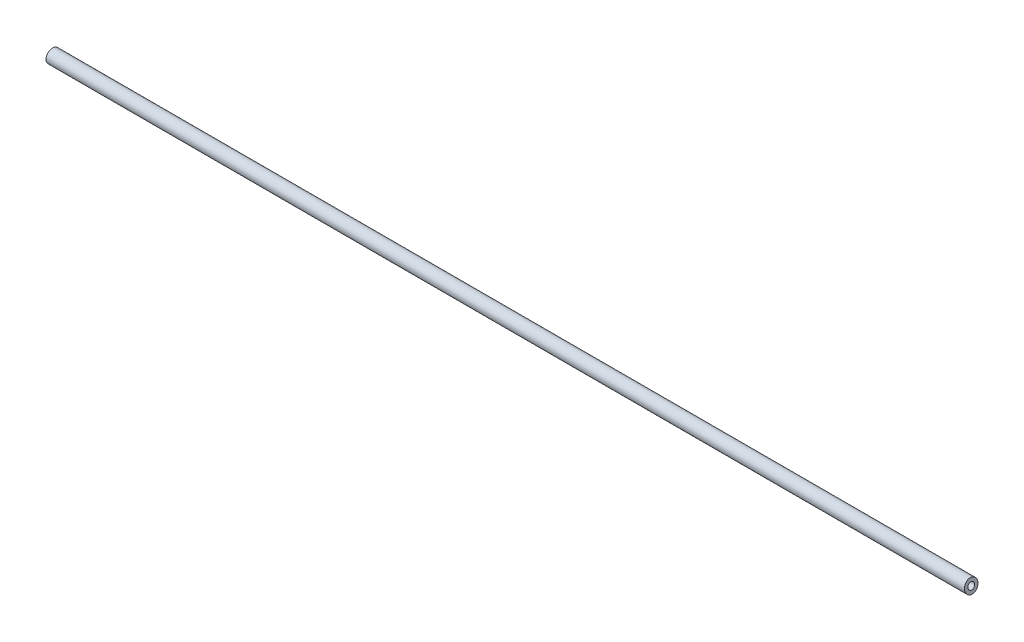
SolidWorks part; units mm, degrees
ref_plane "Plan de face" through (0, 0, 0) normal (0, 0, 1) x (1, 0, 0)
ref_plane "Plan de dessus" through (0, 0, 0) normal (0, 1, 0) x (1, 0, 0)
ref_plane "Plan de droite" through (0, 0, 0) normal (1, 0, 0) x (0, 0, -1)
sketch "Esquisse1" plane through (0, 0, 0) normal (0, 0, 1) x (1, 0, 0)
  line L0 (0, 0) -> (-90.1517, 0) construction
  line L1 (215, 1) -> (-60, 1)
  line L2 (215, 1) -> (215, 2)
  line L3 (215, 2) -> (-60, 2)
  line L4 (-60, 1) -> (-60, 2)
  dimension "D1" = 275
  dimension "D2" = 1
  dimension "D3" = 1
revolve "Révolution1" add sketch "Esquisse1" angle 360 about L0
sketch "Esquisse2" plane through (0, 0, 0) normal (0, 0, 1) x (1, 0, 0)
  line L0 (215, -2) -> (214.4022, 2)
  line L1 (215, -2) -> (215, 2) construction
  line L2 (215, 2) -> (-60, 2) construction
  dimension "D1" = 8.5
extrude "Extrusion1" cut sketch "Esquisse2" against normal through all and the other way through all flip side to cut
